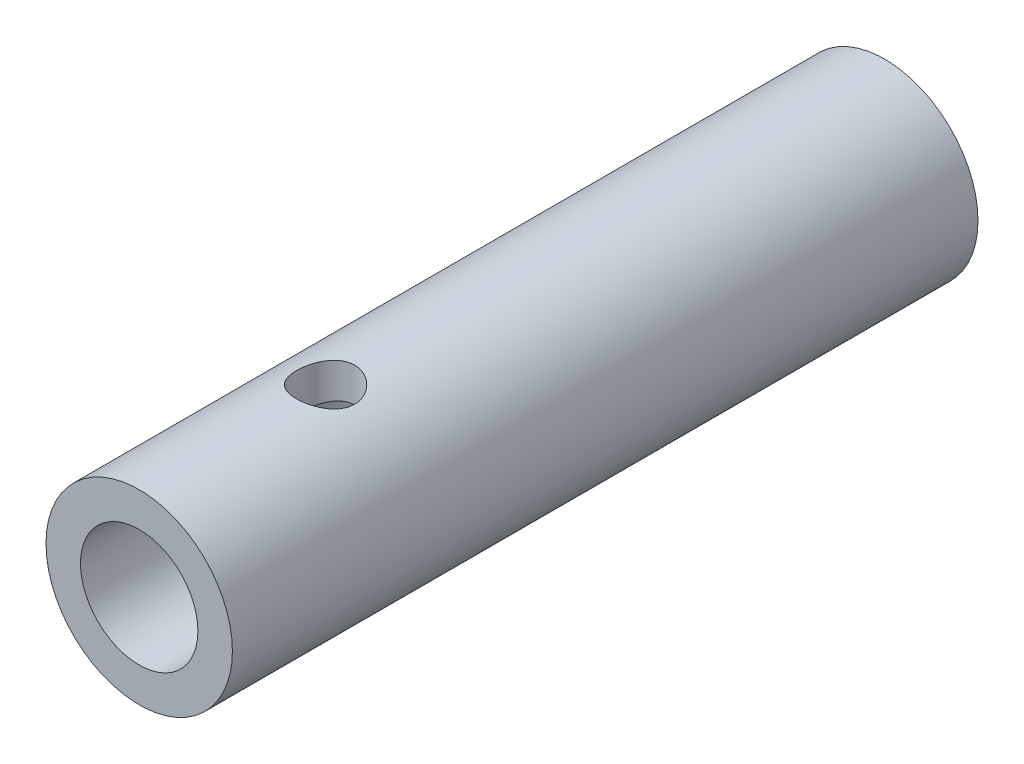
SolidWorks part; units mm, degrees
ref_plane "Front Plane" through (0, 0, 0) normal (0, 0, 1) x (1, 0, 0)
ref_plane "Top Plane" through (0, 0, 0) normal (0, 1, 0) x (1, 0, 0)
ref_plane "Right Plane" through (0, 0, 0) normal (1, 0, 0) x (0, 0, -1)
sketch "Sketch1" plane through (0, 0, 0) normal (0, 0, 1) x (1, 0, 0)
  circle A0 centre (0, 0) radius 3.175
  dimension "D2" = 6.35
extrude "Boss-Extrude1" add sketch "Sketch1" along normal mid plane 25.4
sketch "Sketch2" plane through (0, 0, 12.7) normal (0, 0, 1) x (1, 0, 0)
  circle A0 centre (0, 0) radius 2
  dimension "D1" = 4
extrude "Cut-Extrude1" cut sketch "Sketch2" against normal blind 9.525
sketch "Sketch3" plane through (0, 0, 0) normal (0, 1, 0) x (1, 0, 0)
  line L0 (0, -12.7) -> (0, 0) construction
  line L1 (-3.175, -12.7) -> (3.175, -12.7) construction
  circle A0 centre (0, -6.35) radius 0.9922
  dimension "D1" = 1.9844
  dimension "D2" = 6.35
extrude "Cut-Extrude2" cut sketch "Sketch3" along normal blind 9.525
